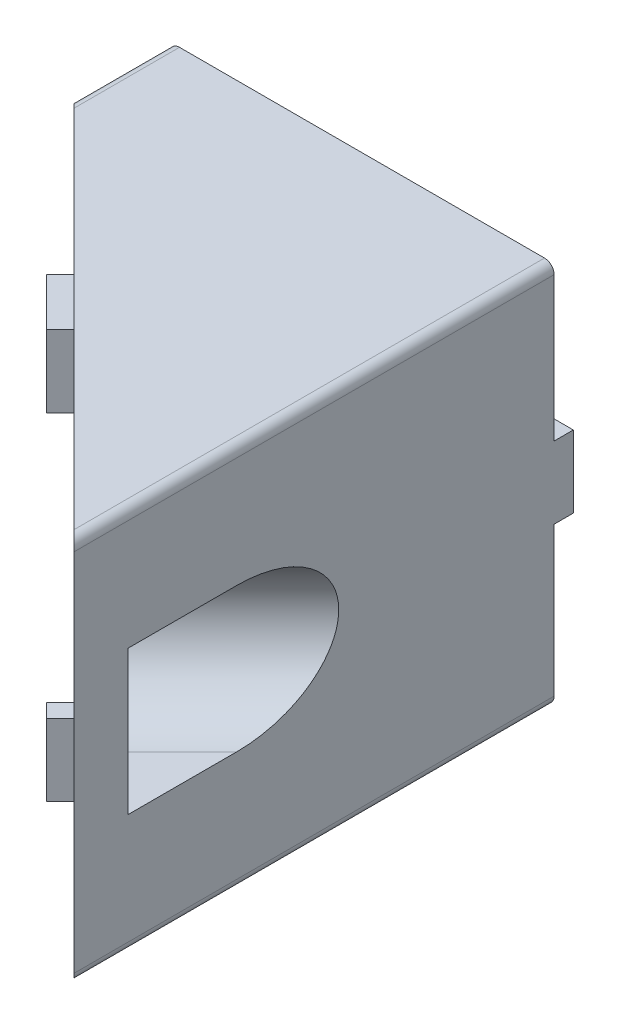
SolidWorks part; units mm, degrees
ref_plane "前视基准面" through (0, 0, 0) normal (0, 0, 1) x (1, 0, 0)
ref_plane "上视基准面" through (0, 0, 0) normal (0, 1, 0) x (1, 0, 0)
ref_plane "右视基准面" through (0, 0, 0) normal (1, 0, 0) x (0, 0, -1)
sketch "草图1" plane through (0, 0, 0) normal (0, 0, 1) x (1, 0, 0)
  line L1 (-20, 20) -> (20, 20)
  line L2 (-20, 20) -> (-20, -20)
  line L3 (-20, -20) -> (20, -20)
  line L4 (20, 20) -> (20, -20)
  dimension "D1" = 40
  dimension "D2" = 40
  dimension "D3" = 20
extrude "凸台-拉伸1" add sketch "草图1" along normal mid plane 50
sketch "草图3" plane through (0, 0, -25) normal (0, 0, -1) x (-1, 0, 0)
  circle A0 centre (0, 0) radius 4
extrude "切除-拉伸1" cut sketch "草图3" against normal blind 50
sketch "草图4" plane through (0, 0, 25) normal (0, 0, 1) x (1, 0, 0)
  circle A0 centre (0, 0) radius 7.5
extrude "切除-拉伸2" cut sketch "草图4" against normal blind 42
sketch "草图6" plane through (0, 0, 25) normal (0, 0, 1) x (1, 0, 0)
  line L0 (20, 20) -> (-20, 20) construction
  line L1 (-17, 17) -> (17, 17)
  line L2 (-17, 17) -> (-17, 11)
  line L3 (-17, 11) -> (17, 11)
  line L4 (17, 17) -> (17, 11)
  line L5 (-20, 20) -> (-20, -20) construction
  line L6 (20, -20) -> (20, 20) construction
  line L7 (0, 0) -> (20, 0) construction
  line L8 (17, -17) -> (17, -11)
  line L9 (-17, -11) -> (17, -11)
  line L10 (-17, -17) -> (-17, -11)
  line L11 (-17, -17) -> (17, -17)
  dimension "D1" = 6
  dimension "D2" = 3
  dimension "D3" = 3
  dimension "D4" = 3
extrude "切除-拉伸4" cut sketch "草图6" against normal blind 36
sketch "草图7" plane through (0, -20, 0) normal (0, -1, 0) x (1, 0, 0)
  line L0 (20, 25) -> (-20, -15)
  line L1 (-20, 25) -> (-20, -25) construction
  line L2 (-20, -15) -> (-20, 25)
  line L3 (-20, 25) -> (20, 25)
  dimension "D1" = 45
extrude "切除-拉伸5" cut sketch "草图7" against normal through all
ref_plane "基准面1" through (0.3284, 0, -0.3284) normal (-0.7071, 0, 0.7071) x (0.7071, 0, 0.7071)
sketch "草图9" plane through (-2.5, 0, 2.5) normal (-0.7071, 0, 0.7071) x (0.7071, 0, 0.7071)
  line L0 (31.8198, -20) -> (31.8198, 20) construction
  circle A0 centre (19.8198, 0) radius 4.25
  dimension "D1" = 12
extrude "切除-拉伸6" cut sketch "草图9" against normal through all
sketch "草图11" plane through (0.3284, 0, -0.3284) normal (-0.7071, 0, 0.7071) x (0.7071, 0, 0.7071)
  line L0 (19.8198, 7.5) -> (27.8198, 7.5)
  line L1 (27.8198, 7.5) -> (27.8198, -7.5)
  line L2 (27.8198, -7.5) -> (19.8198, -7.5)
  arc A0 (19.8198, 7.5) -> (19.8198, -7.5) centre (19.8198, 0) ccw
extrude "切除-拉伸7" cut sketch "草图11" against normal blind 36
sketch "草图12" plane through (-2.5, 0, 2.5) normal (-0.7071, 0, 0.7071) x (0.7071, 0, 0.7071)
  line L0 (-24.7487, 20) -> (-24.7487, -20) construction
  line L1 (-24.7487, 4) -> (-17.7487, 4)
  line L2 (-24.7487, 4) -> (-24.7487, -3.5)
  line L3 (-24.7487, -3.5) -> (-17.7487, -3.5)
  line L4 (-17.7487, 4) -> (-17.7487, -3.5)
  line L5 (31.8198, -20) -> (31.8198, 20) construction
  line L6 (31.8198, 4) -> (29.8198, 4)
  line L7 (31.8198, 4) -> (31.8198, -3.5)
  line L8 (31.8198, -3.5) -> (29.8198, -3.5)
  line L9 (29.8198, 4) -> (29.8198, -3.5)
  dimension "D1" = 7
  dimension "D2" = 7.5
  dimension "D3" = 3.5
  dimension "D4" = 7.5
  dimension "D5" = 2
  dimension "D6" = 3.5
extrude "凸台-拉伸2" add sketch "草图12" along normal blind 2
sketch "草图14" plane through (0, 0, -17) normal (0, 0, 1) x (1, 0, 0)
  line L1 (0, 7.5) -> (-9, 7.5)
  line L2 (0, 7.5) -> (0, -7.5)
  line L3 (0, -7.5) -> (-9, -7.5)
  line L4 (-9, 7.5) -> (-9, -7.5)
  circle A0 centre (0, 0) radius 7.5 construction
  dimension "D1" = 9
extrude "切除-拉伸8" cut sketch "草图14" along normal through all
ref_plane "基准面3" through (-4.7721, 0, -4.7721) normal (0.7071, 0, 0.7071) x (0.7071, 0, -0.7071)
sketch "草图16" plane through (-4.7721, 0, -4.7721) normal (0.7071, 0, 0.7071) x (0.7071, 0, -0.7071)
  line L0 (8.4645, 7.5) -> (0.4645, 7.5) construction
  line L1 (5.3799, 7.5) -> (-5.6201, 7.5)
  line L2 (5.3799, 7.5) -> (5.3799, -7.5)
  line L3 (5.3799, -7.5) -> (-5.6201, -7.5)
  line L4 (-5.6201, 7.5) -> (-5.6201, -7.5)
  dimension "D1" = 11
extrude "切除-拉伸9" cut sketch "草图16" against normal up to surface (11 mm away)
sketch "草图17" plane through (0, 0, -25) normal (0, 0, -1) x (-1, 0, 0)
  line L1 (-20, 4) -> (-18, 4)
  line L2 (-20, 4) -> (-20, -3.5)
  line L3 (-20, -3.5) -> (-18, -3.5)
  line L4 (-18, 4) -> (-18, -3.5)
  line L5 (0, 4) -> (0, -4) construction
  line L6 (18, 4) -> (18, -3.5)
  line L7 (20, -3.5) -> (18, -3.5)
  line L8 (20, 4) -> (20, -3.5)
  line L10 (20, 4) -> (18, 4)
  circle A0 centre (0, 0) radius 4 construction
  dimension "D1" = 2
  dimension "D2" = 7.5
extrude "凸台-拉伸3" add sketch "草图17" along normal blind 2
fillet "圆角1" radius 1 4 edges at (-20, -20, -20) (20, -20, 0) (20, 20, 0) (-20, 20, -20)
